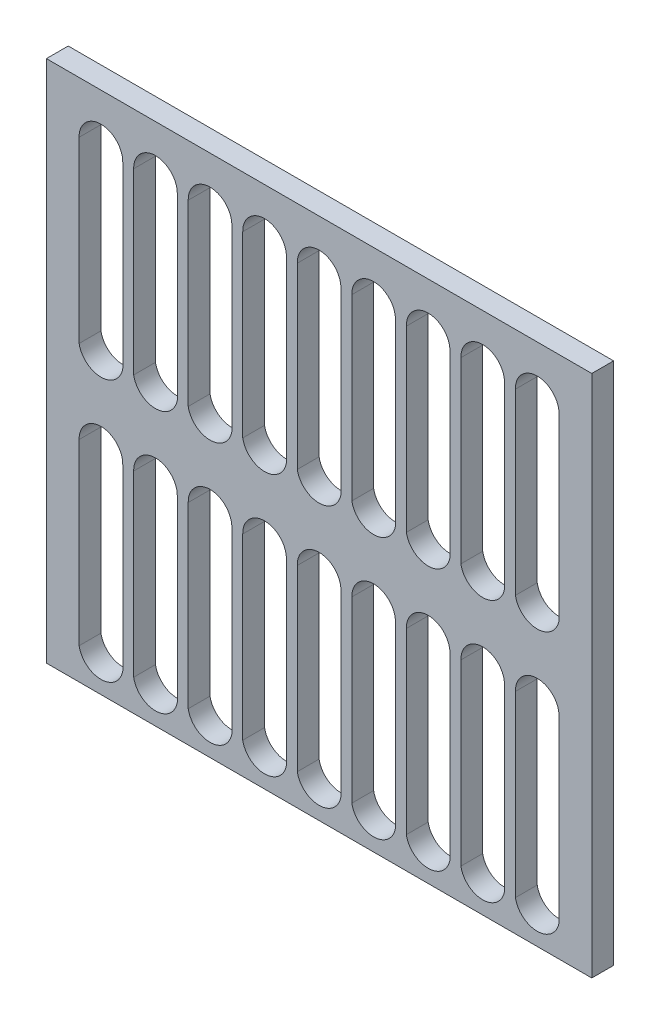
SolidWorks part; units mm, degrees
ref_plane "Front" through (0, 0, 0) normal (0, 0, 1) x (1, 0, 0)
ref_plane "Top" through (0, 0, 0) normal (0, 1, 0) x (1, 0, 0)
ref_plane "Right" through (0, 0, 0) normal (1, 0, 0) x (0, 0, -1)
sketch "Sketch1" plane through (0, 0, 0) normal (0, 0, 1) x (1, 0, 0)
  line L0 (-65, -23.72) -> (-65, -105.6)
  line L1 (-125, 120) -> (125, 120)
  line L2 (-125, 120) -> (-125, -120)
  line L3 (-125, -120) -> (125, -120)
  line L4 (125, 120) -> (125, -120)
  line L5 (-125, 120) -> (125, -120) construction
  line L6 (-125, -120) -> (125, 120) construction
  line L13 (-90, -23.72) -> (-90, -105.6)
  line L15 (-110, -23.72) -> (-110, -105.6)
  line L16 (-85, -23.72) -> (-85, -105.6)
  line L17 (-40, -23.72) -> (-40, -105.6)
  line L18 (-60, -23.72) -> (-60, -105.6)
  line L19 (-15, -23.72) -> (-15, -105.6)
  line L20 (-35, -23.72) -> (-35, -105.6)
  line L21 (10, -23.72) -> (10, -105.6)
  line L22 (-10, -23.72) -> (-10, -105.6)
  line L23 (35, -23.72) -> (35, -105.6)
  line L24 (15, -23.72) -> (15, -105.6)
  line L25 (60, -23.72) -> (60, -105.6)
  line L26 (40, -23.72) -> (40, -105.6)
  line L27 (85, -23.72) -> (85, -105.6)
  line L28 (65, -23.72) -> (65, -105.6)
  line L29 (110, -23.72) -> (110, -105.6)
  line L30 (90, -23.72) -> (90, -105.6)
  line L31 (-65, 96.28) -> (-65, 14.4)
  line L32 (-85, 96.28) -> (-85, 14.4)
  line L33 (-40, 96.28) -> (-40, 14.4)
  line L34 (-60, 96.28) -> (-60, 14.4)
  line L35 (-15, 96.28) -> (-15, 14.4)
  line L36 (-35, 96.28) -> (-35, 14.4)
  line L37 (10, 96.28) -> (10, 14.4)
  line L38 (-10, 96.28) -> (-10, 14.4)
  line L39 (35, 96.28) -> (35, 14.4)
  line L40 (15, 96.28) -> (15, 14.4)
  line L41 (60, 96.28) -> (60, 14.4)
  line L42 (40, 96.28) -> (40, 14.4)
  line L43 (85, 96.28) -> (85, 14.4)
  line L44 (65, 96.28) -> (65, 14.4)
  line L45 (110, 96.28) -> (110, 14.4)
  line L46 (90, 96.28) -> (90, 14.4)
  line L47 (-90, 96.28) -> (-90, 14.4)
  line L48 (-110, 96.28) -> (-110, 14.4)
  arc A2 (-110, -23.72) -> (-90, -23.72) centre (-100, -23.5198) cw
  arc A3 (-110, -105.6) -> (-90, -105.6) centre (-100, -103.7954) ccw
  arc A4 (-85, -23.72) -> (-65, -23.72) centre (-75, -23.5198) cw
  arc A5 (-85, -105.6) -> (-65, -105.6) centre (-75, -103.7954) ccw
  arc A6 (-60, -23.72) -> (-40, -23.72) centre (-50, -23.5198) cw
  arc A7 (-60, -105.6) -> (-40, -105.6) centre (-50, -103.7954) ccw
  arc A8 (-35, -23.72) -> (-15, -23.72) centre (-25, -23.5198) cw
  arc A9 (-35, -105.6) -> (-15, -105.6) centre (-25, -103.7954) ccw
  arc A10 (-10, -23.72) -> (10, -23.72) centre (0, -23.5198) cw
  arc A11 (-10, -105.6) -> (10, -105.6) centre (0, -103.7954) ccw
  arc A12 (15, -23.72) -> (35, -23.72) centre (25, -23.5198) cw
  arc A13 (15, -105.6) -> (35, -105.6) centre (25, -103.7954) ccw
  arc A14 (40, -23.72) -> (60, -23.72) centre (50, -23.5198) cw
  arc A15 (40, -105.6) -> (60, -105.6) centre (50, -103.7954) ccw
  arc A16 (65, -23.72) -> (85, -23.72) centre (75, -23.5198) cw
  arc A17 (65, -105.6) -> (85, -105.6) centre (75, -103.7954) ccw
  arc A18 (90, -23.72) -> (110, -23.72) centre (100, -23.5198) cw
  arc A19 (90, -105.6) -> (110, -105.6) centre (100, -103.7954) ccw
  arc A20 (-85, 96.28) -> (-65, 96.28) centre (-75, 96.4802) cw
  arc A21 (-85, 14.4) -> (-65, 14.4) centre (-75, 16.2046) ccw
  arc A22 (-60, 96.28) -> (-40, 96.28) centre (-50, 96.4802) cw
  arc A23 (-60, 14.4) -> (-40, 14.4) centre (-50, 16.2046) ccw
  arc A24 (-35, 96.28) -> (-15, 96.28) centre (-25, 96.4802) cw
  arc A25 (-35, 14.4) -> (-15, 14.4) centre (-25, 16.2046) ccw
  arc A26 (-10, 96.28) -> (10, 96.28) centre (0, 96.4802) cw
  arc A27 (-10, 14.4) -> (10, 14.4) centre (0, 16.2046) ccw
  arc A28 (15, 96.28) -> (35, 96.28) centre (25, 96.4802) cw
  arc A29 (15, 14.4) -> (35, 14.4) centre (25, 16.2046) ccw
  arc A30 (40, 96.28) -> (60, 96.28) centre (50, 96.4802) cw
  arc A31 (40, 14.4) -> (60, 14.4) centre (50, 16.2046) ccw
  arc A32 (65, 96.28) -> (85, 96.28) centre (75, 96.4802) cw
  arc A33 (65, 14.4) -> (85, 14.4) centre (75, 16.2046) ccw
  arc A34 (90, 96.28) -> (110, 96.28) centre (100, 96.4802) cw
  arc A35 (90, 14.4) -> (110, 14.4) centre (100, 16.2046) ccw
  arc A36 (-110, 96.28) -> (-90, 96.28) centre (-100, 96.4802) cw
  arc A37 (-110, 14.4) -> (-90, 14.4) centre (-100, 16.2046) ccw
  point P0 (0, 0)
  dimension "D1" = 250
  dimension "D2" = 240
  dimension "D3" = 15
  dimension "D4" = 9
  dimension "D5" = 2
extrude "Boss-Extrude2" add sketch "Sketch1" along normal blind 10
